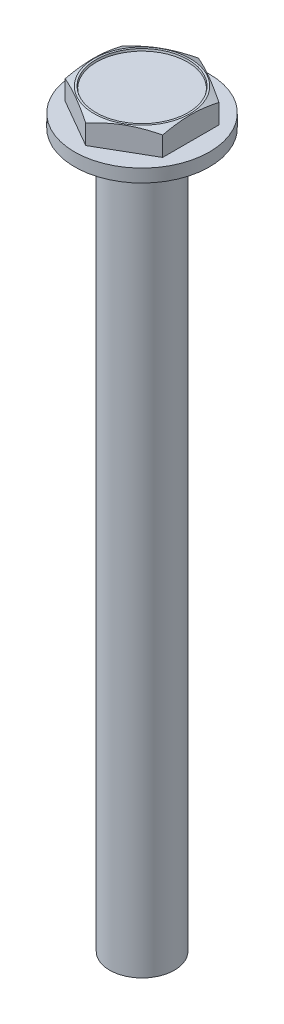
SolidWorks part; units mm, degrees
ref_plane "Plane1" through (0, 0, 0) normal (0, 0, 1) x (1, 0, 0)
ref_plane "Plane2" through (0, 0, 0) normal (0, 1, 0) x (1, 0, 0)
ref_plane "Plane3" through (0, 0, 0) normal (1, 0, 0) x (0, 0, -1)
revolve "Boss-Revolve1" add sketch "Sketch2" angle 360 about L0
sketch "Sketch2" plane through (0, 0, 0) normal (0, 0, 1) x (1, 0, 0)
  line L0 (0, 0) -> (0, 100) construction
  line L1 (0, -34.925) -> (1.5875, -34.925)
  line L2 (1.5875, -34.925) -> (1.5875, 0)
  line L3 (1.5875, 0) -> (0, 0)
  line L4 (0, 0) -> (0, -34.925)
  dimension "D1" = 34.925
revolve "Base-Revolve" add sketch "Sketch1" angle 360 about L7
sketch "Sketch1" plane through (0, 0, 0) normal (0, 0, 1) x (1, 0, 0)
  line L0 (0, 0) -> (3.302, 0)
  line L1 (3.302, 0) -> (3.302, 1.3325)
  line L2 (3.302, 1.3325) -> (2.3466, 1.778)
  line L3 (2.3466, 1.778) -> (2.2527, 1.778)
  line L4 (2.2527, 1.778) -> (2.2292, 1.6841)
  line L5 (2.2292, 1.6841) -> (0, 1.6841)
  line L6 (0, 1.6841) -> (0, 0)
  line L7 (0, 0) -> (0, 100) construction
ref_plane "Plane4" through (0, 1.778, 0) normal (0, 1, 0) x (-1, 0, 0)
sketch "Sketch3" plane through (0, 1.778, 0) normal (0, 1, 0) x (-1, 0, 0)
  line L0 (2.3876, 1.3785) -> (0, 2.757)
  line L1 (0, 2.757) -> (-2.3876, 1.3785)
  line L2 (-2.3876, 1.3785) -> (-2.3876, -1.3785)
  line L3 (-2.3876, -1.3785) -> (0, -2.757)
  line L4 (0, -2.757) -> (2.3876, -1.3785)
  line L5 (2.3876, -1.3785) -> (2.3876, 1.3785)
  line L6 (3.6322, 3.6322) -> (-3.6322, 3.6322)
  line L7 (-3.6322, 3.6322) -> (-3.6322, -3.6322)
  line L8 (-3.6322, -3.6322) -> (3.6322, -3.6322)
  line L9 (3.6322, -3.6322) -> (3.6322, 3.6322)
extrude "Cut-Extrude1" cut sketch "Sketch3" against normal blind 1.143
